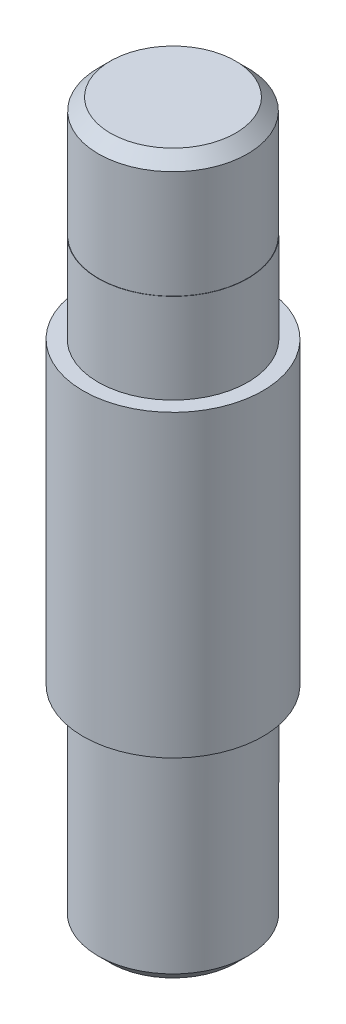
SolidWorks part; units mm, degrees
ref_plane "Front" through (0, 0, 0) normal (0, 0, 1) x (1, 0, 0)
ref_plane "Top" through (0, 0, 0) normal (0, 1, 0) x (1, 0, 0)
ref_plane "Right" through (0, 0, 0) normal (1, 0, 0) x (0, 0, -1)
sketch "Sketch1" plane through (0, 0, 0) normal (0, 1, 0) x (1, 0, 0)
  circle A0 centre (0, 0) radius 3
extrude "Extrude1" add sketch "Sketch1" along normal blind 10
sketch "Sketch2" plane through (0, 10, 0) normal (0, 1, 0) x (-1, 0, 0)
  circle A0 centre (0, 0) radius 2.5
extrude "Extrude2" add sketch "Sketch2" along normal blind 3
sketch "Sketch3" plane through (0, 13, 0) normal (0, 1, 0) x (-1, 0, 0)
  circle A0 centre (0, 0) radius 2.49
extrude "Extrude3" add sketch "Sketch3" along normal blind 4
sketch "Sketch4" plane through (0, 0, 0) normal (0, -1, 0) x (1, 0, 0)
  circle A0 centre (0, 0) radius 2.5
extrude "Extrude4" add sketch "Sketch4" along normal blind 7
chamfer "Chamfer1" distance 0.4 angle 45 2 edges at (0, -7, -2.5) (0, 17, 2.49)
